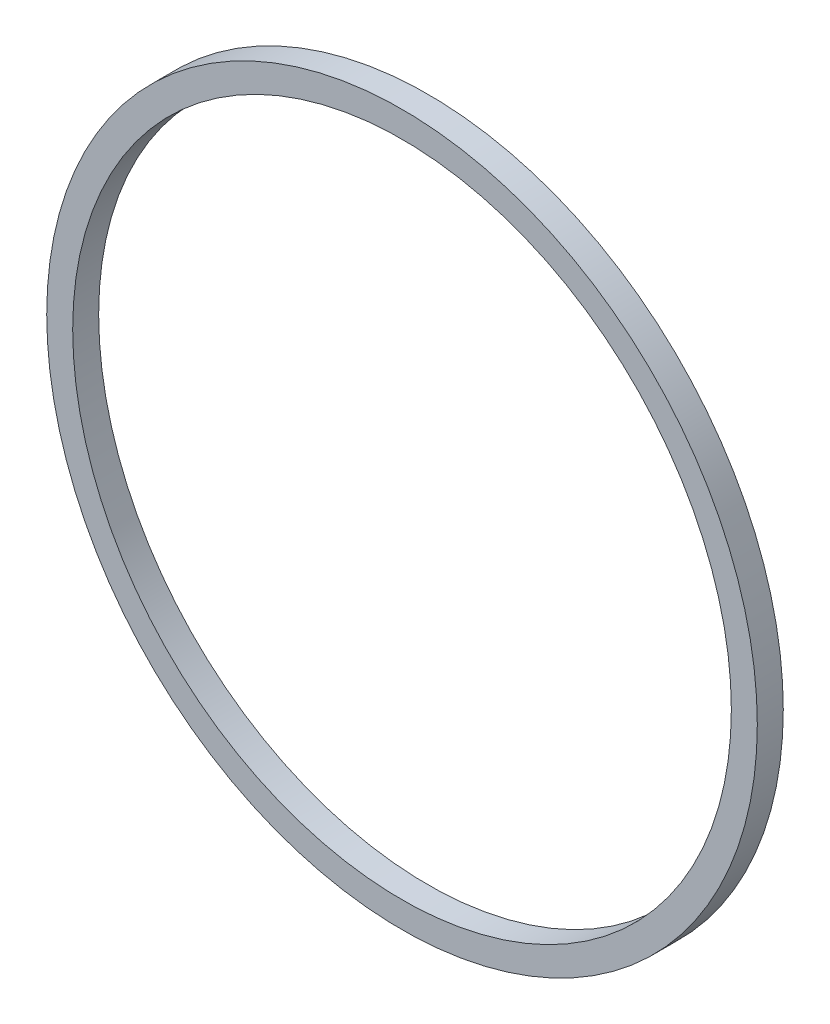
SolidWorks part; units mm, degrees
ref_plane "Front" through (0, 0, 0) normal (0, 0, 1) x (1, 0, 0)
ref_plane "Top" through (0, 0, 0) normal (0, 1, 0) x (1, 0, 0)
ref_plane "Right" through (0, 0, 0) normal (1, 0, 0) x (0, 0, -1)
sketch "Sketch1" plane through (0, 0, 0) normal (0, 1, 0) x (1, 0, 0)
  line L0 (0, -3.4925) -> (0, 3.4925) construction
  line L1 (0, -0.9779) -> (0, 0.9779) construction
  line L3 (-88.5825, 0) -> (88.5825, 0) construction
  line L4 (88.5825, -3.4925) -> (88.5825, 3.4925)
  line L5 (88.5825, -3.4925) -> (95.5675, -3.4925)
  line L6 (88.5825, 3.4925) -> (95.5675, 3.4925)
  line L7 (95.5675, -3.4925) -> (95.5675, 3.4925)
  point P9 (88.5825, 0)
  dimension "Actual ID" = 177.165
  dimension "Actual Width" = 6.985
revolve "Revolve1" add sketch "Sketch1" angle 360 about L0
